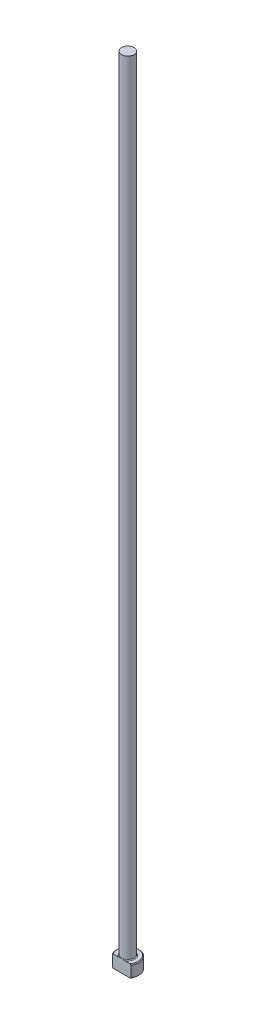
SolidWorks part; units mm, degrees
ref_plane "Front Plane" through (0, 0, 0) normal (0, 0, 1) x (1, 0, 0)
ref_plane "Top Plane" through (0, 0, 0) normal (0, 1, 0) x (1, 0, 0)
ref_plane "Right Plane" through (0, 0, 0) normal (1, 0, 0) x (0, 0, -1)
sketch "Sketch1" plane through (0, 0, 0) normal (0, 0, 1) x (1, 0, 0)
  line L0 (0, 259.9588) -> (0, -15.1925) construction
  line L1 (0, 0) -> (-3.5687, 0)
  line L2 (-3.5687, 0) -> (-3.5687, 3.9624)
  line L3 (-3.5687, 3.9624) -> (-1.9837, 3.9624)
  line L4 (-1.9837, 3.9624) -> (-1.9837, 254)
  line L5 (-1.9837, 254) -> (0, 254)
  line L6 (0, 254) -> (0, 0)
  dimension "L" = 254
  dimension "H" = 7.1374
  dimension "T" = 3.9624
  dimension "D" = 3.9675
revolve "Revolve1" add sketch "Sketch1" angle 360 about L0
chamfer "Chamfer1" distance 0.254 angle 45 2 edges at (0, 3.9624, 3.5687) (0, 0, 3.5687)
fillet "Fillet1" radius 0.254 1 edges at (0, 3.9624, 1.9837)
sketch "Sketch2" plane through (0, 0, 0) normal (0, 1, 0) x (1, 0, 0)
  line L0 (-2.9665, -1.9837) -> (2.9665, -1.9837)
  circle A0 centre (0, 0) radius 3.5687 construction
  arc A1 (-2.9665, -1.9837) -> (2.9665, -1.9837) centre (0, 0) ccw
  circle A3 centre (0, 0) radius 1.9837 construction
  dimension "D1" = 0
extrude "Key" cut sketch "Sketch2" along normal through all
sketch "Pocket Sketch" plane through (0, 0, 0) normal (0, 0, 1) x (1, 0, 0)
  line L0 (-3.9656, 0) -> (-3.9656, 3.9878)
  line L1 (-3.9656, 3.9878) -> (-2.9442, 3.9878)
  line L2 (-2.1822, 4.7498) -> (-2.1822, 22.225)
  line L3 (-2.1822, 22.225) -> (0, 22.225)
  line L4 (0, 22.225) -> (0, 0)
  line L5 (0, 0) -> (-3.9656, 0)
  line L6 (0, 12.6104) -> (0, -2.4989) construction
  line L7 (-3.5687, 3.7084) -> (-3.5687, 0.254) construction
  line L8 (3.3147, 3.9624) -> (-3.3147, 3.9624) construction
  line L9 (-1.9837, 254) -> (-1.9837, 4.2164) construction
  line L10 (-2.9442, 3.9878) -> (-2.1822, 4.7498)
  point P3 (-2.1822, 3.9878)
  dimension "D1" = 7.9311
  dimension "D2" = 0.3969
  dimension "D3" = 0.0254
  dimension "D4" = 0.1984
  dimension "D5" = 4.3644
  dimension "D6" = 22.225
